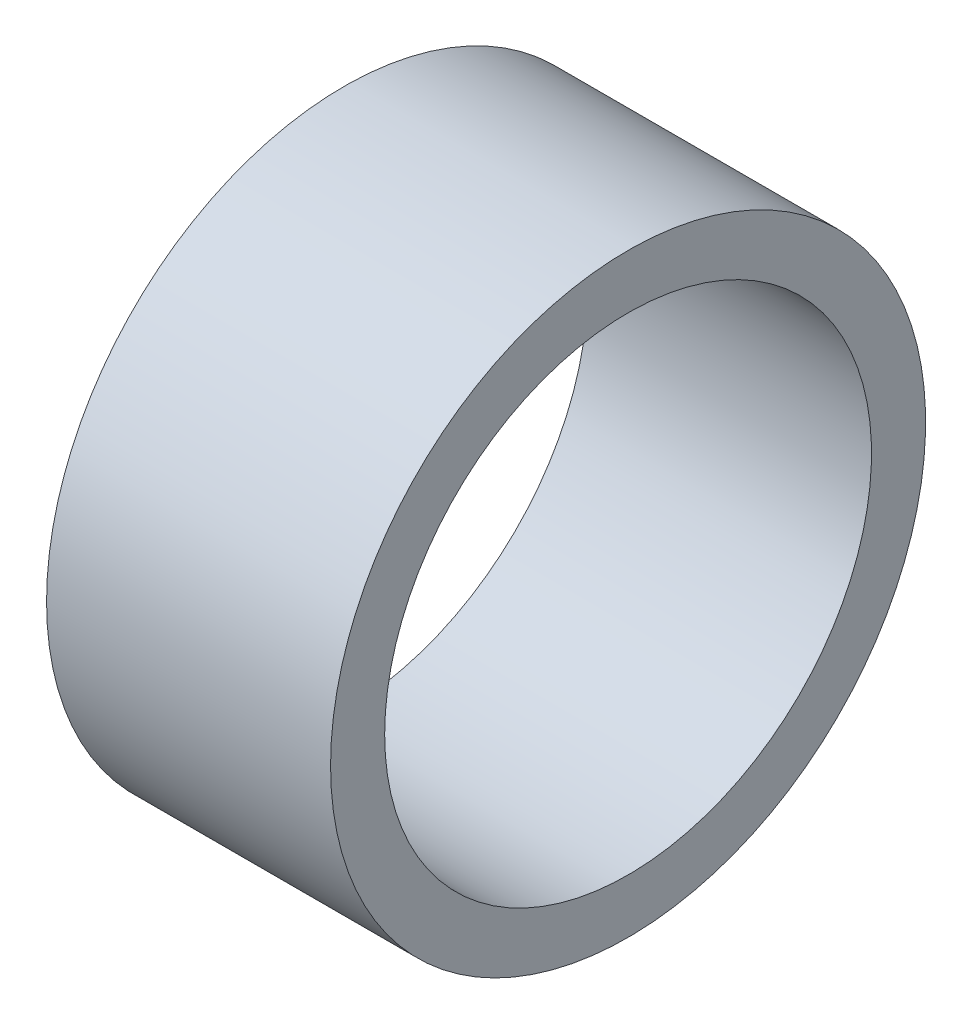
SolidWorks part; units mm, degrees
ref_plane "Plan de face" through (0, 0, 0) normal (0, 0, 1) x (1, 0, 0)
ref_plane "Plan de dessus" through (0, 0, 0) normal (0, 1, 0) x (1, 0, 0)
ref_plane "Plan de droite" through (0, 0, 0) normal (1, 0, 0) x (0, 0, -1)
ref_plane "Plan4" through (0, 0, 0) normal (0, 0, -1) x (-1, 0, 0)
sketch "Esquisse1" plane through (0, 0, 0) normal (0, 0, -1) x (-1, 0, 0)
  line L0 (-21, 22) -> (-21, 18)
  line L1 (-21, 18) -> (0, 18)
  line L2 (0, 18) -> (0, 22)
  line L3 (0, 22) -> (-21, 22)
  line L4 (-21, 0) -> (0, 0) construction
revolve "Révolution1" add sketch "Esquisse1" angle 360 about L4
